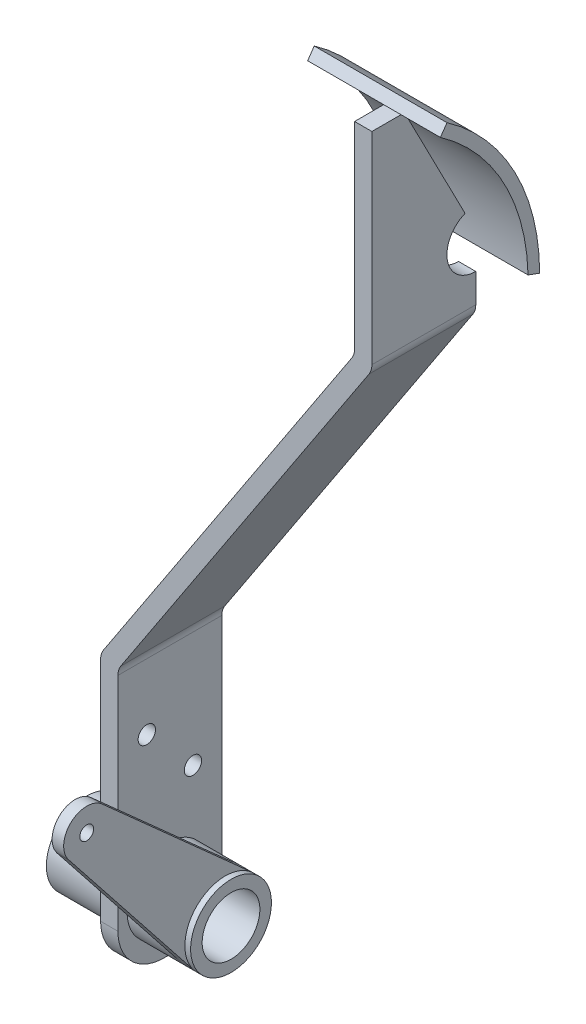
SolidWorks part; units mm, degrees
ref_plane "Plan de face" through (0, 0, 0) normal (0, 0, 1) x (1, 0, 0)
ref_plane "Plan de dessus" through (0, 0, 0) normal (0, 1, 0) x (1, 0, 0)
ref_plane "Plan de droite" through (0, 0, 0) normal (1, 0, 0) x (0, 0, -1)
sketch "Esquisse1" plane through (0, 0, 0) normal (0, 0, 1) x (1, 0, 0)
  line L0 (0, 0) -> (0, 48.1868)
  line L1 (0, 48.1868) -> (44, 115)
  line L2 (44, 115) -> (44, 150)
  dimension "D1" = 150
  dimension "D2" = 80
  dimension "D3" = 35
  dimension "D4" = 44
extrude "Extru.-Mince1" add sketch "Esquisse1" along normal blind 18 thin
fillet "Congé1" radius 3 4 edges at (47, 114.1009, 9) (44, 115, 9) (0, 48.1868, 9) (3, 47.2877, 9)
sketch "Esquisse8" plane through (47, 0, 0) normal (1, 0, 0) x (0, 0, -1)
  line L0 (-17.0728, 159.1366) -> (8.2845, 109.9863)
extrude "Enlèv. mat.-Extru.4" cut sketch "Esquisse8" against normal through all and the other way through all
sketch "Esquisse2" plane through (47, 0, 0) normal (1, 0, 0) x (0, 0, -1)
  line L0 (0, 115) -> (0, 126.0442) construction
  line L1 (-18, 150) -> (-12.3591, 150) construction
  circle A0 centre (0, 125) radius 5
  dimension "D1" = 10
  dimension "D2" = 25
extrude "Enlèv. mat.-Extru.1" cut sketch "Esquisse2" against normal through all
sketch "Esquisse3" plane through (47, 0, 0) normal (1, 0, 0) x (0, 0, -1)
  line L0 (-16.1322, 153.1772) -> (-14.9885, 154.8179)
  line L1 (-0.9439, 124.9382) -> (1.0669, 124.1988)
  arc A0 (-0.9439, 124.9382) -> (-16.1322, 153.1772) centre (-36.4329, 124.0545) ccw
  arc A1 (1.0669, 124.1988) -> (-14.9885, 154.8179) centre (-36.4329, 124.0545) ccw
  arc A2 (-68.7505, 138.7453) -> (-19.6344, 155.3285) centre (-36.4329, 124.0545) ccw construction
  arc A3 (-70.5712, 139.573) -> (-18.6881, 157.0904) centre (-36.4329, 124.0545) ccw construction
  dimension "D1" = 35.5
  dimension "D2" = 2
extrude "Extrusion1" add sketch "Esquisse3" along normal blind 10 and the other way blind 13
sketch "Esquisse4" plane through (3, 0, 0) normal (1, 0, 0) x (0, 0, -1)
  line L0 (-18, 0) -> (0, 0) construction
  circle A0 centre (-9.4039, 10) radius 7
  dimension "D1" = 14
  dimension "D2" = 10
extrude "Enlèv. mat.-Extru.2" cut sketch "Esquisse4" against normal through all
fillet "Congé2" radius 8 2 edges at (1.5, 0, 18) (1.5, 0, 0)
sketch "Esquisse5" plane through (3, 0, 0) normal (1, 0, 0) x (0, 0, -1)
  circle A0 centre (-9.4039, 10) radius 7 construction
  circle A1 centre (-9.4039, 10) radius 7
  circle A2 centre (-9.4039, 10) radius 5
  dimension "D1" = 2
extrude "Extrusion2" add sketch "Esquisse5" along normal blind 11 and the other way blind 14
ref_plane "Plan1" through (11, 0, 0) normal (1, 0, 0) x (0, 0, -1)
sketch "Esquisse6" plane through (11, 0, 0) normal (1, 0, 0) x (0, 0, -1)
  line L0 (-14.8917, 5.6544) -> (-36.5398, 32.9923)
  line L1 (-4.739, 15.2191) -> (-30.7382, 38.4578)
  circle A0 centre (-9.4039, 10) radius 7 construction
  circle A1 centre (-33.4039, 35.4755) radius 1.2
  arc A2 (-30.7382, 38.4578) -> (-36.5398, 32.9923) centre (-33.4039, 35.4755) ccw
  arc A3 (-4.739, 15.2191) -> (-14.8917, 5.6544) centre (-9.4039, 10) ccw
  dimension "D1" = 35
  dimension "D2" = 24
  dimension "D3" = 4
  dimension "D4" = 2.4
extrude "Extrusion3" add sketch "Esquisse6" along normal blind 2
sketch "Esquisse7" plane through (3, 0, 0) normal (1, 0, 0) x (0, 0, -1)
  line L0 (-18, 8) -> (-18, 46.3886) construction
  circle A0 centre (-13, 35) radius 1.5
  circle A1 centre (-9.4039, 10) radius 5 construction
  dimension "D1" = 3
  dimension "D2" = 5
  dimension "D3" = 25
extrude "Enlèv. mat.-Extru.3" cut sketch "Esquisse7" against normal through all
sketch "Esquisse9" plane through (3, 0, 0) normal (1, 0, 0) x (0, 0, -1)
  line L0 (0, 8) -> (0, 46.3886) construction
  line L1 (0, 46.3886) -> (-18, 46.3886) construction
  circle A0 centre (-5, 26.3886) radius 1.5
  dimension "D1" = 3
  dimension "D2" = 5
  dimension "D3" = 20
extrude "Enlèv. mat.-Extru.5" cut sketch "Esquisse9" against normal through all
